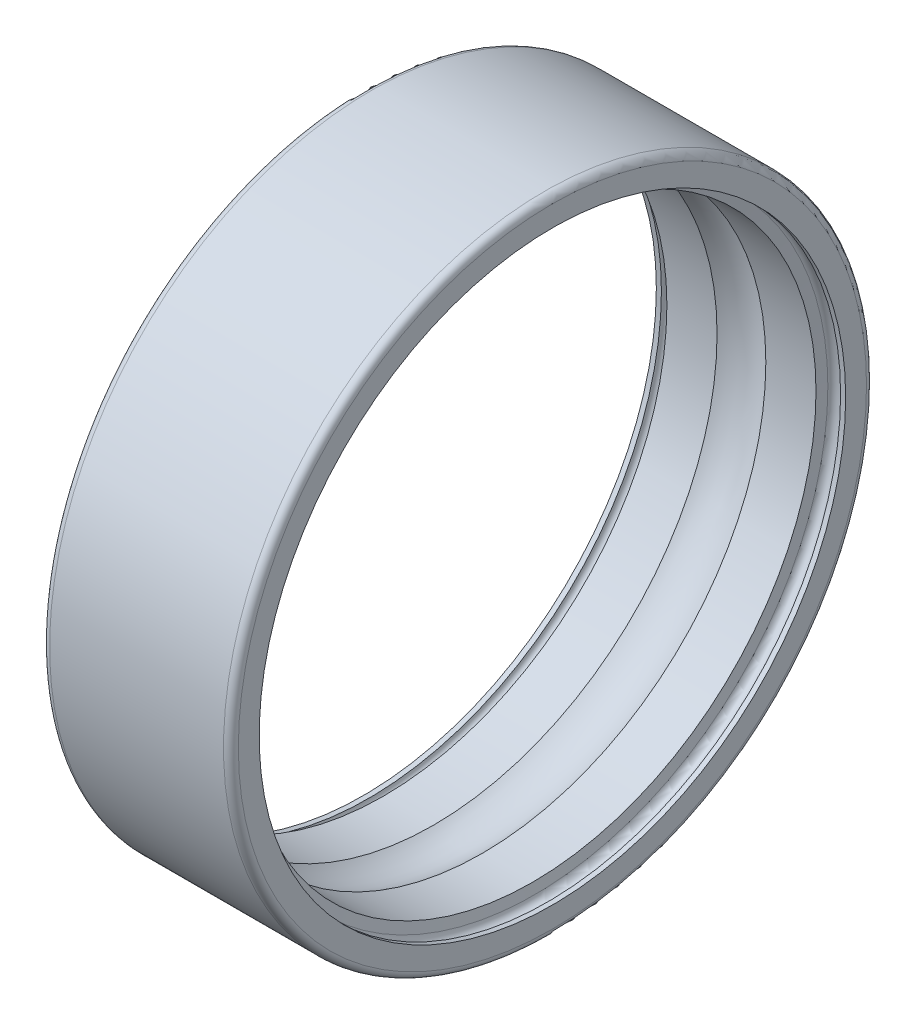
SolidWorks part; units mm, degrees
ref_plane "Front Plane" through (0, 0, 0) normal (0, 0, 1) x (1, 0, 0)
ref_plane "Top Plane" through (0, 0, 0) normal (0, 1, 0) x (1, 0, 0)
ref_plane "Right Plane" through (0, 0, 0) normal (1, 0, 0) x (0, 0, -1)
ref_plane "Plane4" through (0, 0, 0) normal (0, 0, 1) x (1, 0, 0)
sketch "Sketch1" plane through (0, 0, 0) normal (0, 0, 1) x (1, 0, 0)
  line L0 (0, 8.3) -> (0, 7.7487)
  line L1 (0, 7.7487) -> (0.134, 7.749)
  line L2 (0.4824, 7.7675) -> (0.528, 7.5)
  line L3 (0.528, 7.5) -> (1.8549, 7.5)
  line L4 (3.1451, 7.5) -> (4.472, 7.5)
  line L5 (4.472, 7.5) -> (4.5184, 7.7674)
  line L6 (4.866, 7.7566) -> (5, 7.7568)
  line L7 (5, 7.7568) -> (5, 8.3081)
  line L8 (4.8, 8.5) -> (0.2, 8.5)
  line L9 (50, 0) -> (-50, 0) construction
  arc A0 (0.134, 7.749) -> (0.4824, 7.7675) centre (0.3093, 7.738) cw
  arc A1 (1.8549, 7.5) -> (2.5, 7.69) centre (2.5, 6.5) cw
  arc A2 (2.5, 7.69) -> (3.1451, 7.5) centre (2.5, 6.5) cw
  arc A3 (4.5184, 7.7674) -> (4.866, 7.7566) centre (4.6914, 7.7373) cw
  arc A4 (5, 8.3081) -> (4.8, 8.5) centre (4.8079, 8.3081) ccw
  arc A5 (0.2, 8.5) -> (0, 8.3) centre (0.2, 8.3) ccw
  dimension "D5" = 1.19
  dimension "D6" = 1
  dimension "D7" = 2.5
  dimension "D8" = 4.3822
  dimension "D10" = 0.1757
  dimension "D1" = 7.5
  dimension "D2" = 8.5
  dimension "D3" = 5
  dimension "D4" = 1
  dimension "D9" = 0.2373
revolve "Revolve1" add sketch "Sketch1" angle 360 about L9
